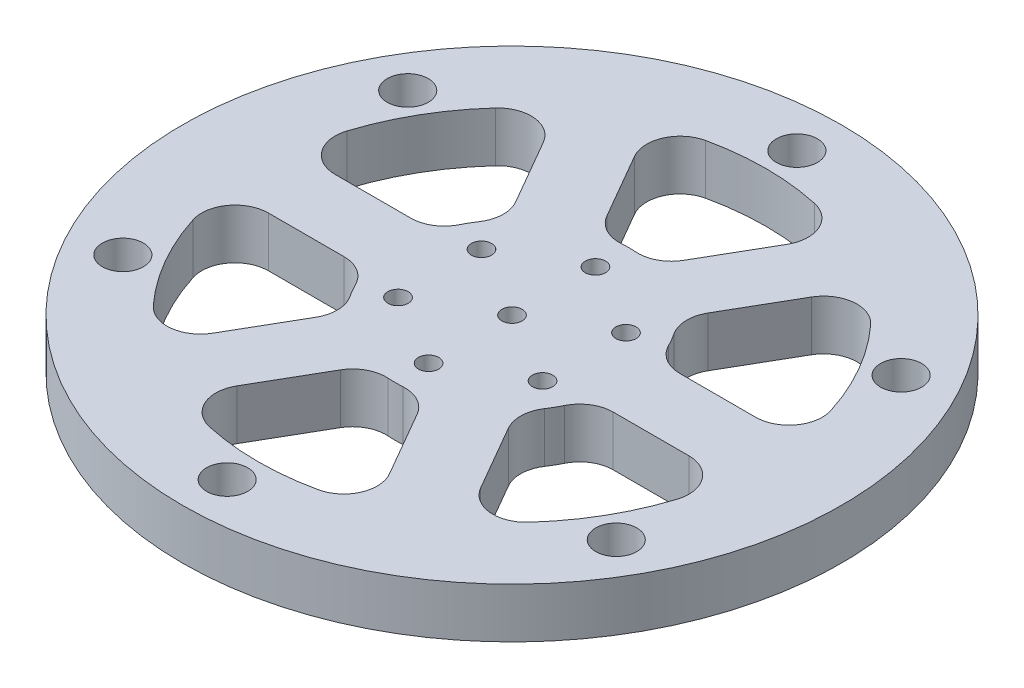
SolidWorks part; units mm, degrees
ref_plane "FRONT" through (0, 0, 0) normal (0, 0, 1) x (1, 0, 0)
ref_plane "TOP" through (0, 0, 0) normal (0, 1, 0) x (1, 0, 0)
ref_plane "RIGHT" through (0, 0, 0) normal (1, 0, 0) x (0, 0, -1)
sketch "Sketch1" plane through (0, 0, 0) normal (0, 1, 0) x (1, 0, 0)
  line L0 (0, 37.0223) -> (0, -37.4376) construction
  line L3 (0, 0) -> (-18.1993, -41.2942) construction
  circle A0 centre (0, 0) radius 31.3531
  circle A1 centre (0, 0) radius 0.9652
  circle A38 centre (0, 0) radius 11.1125 construction
  dimension "D1" = 62.7063
  dimension "D2" = 22.225
  dimension "wireHole" = 1.9304
extrude "Base-Extrude" add sketch "Sketch1" along normal blind 4.7625
sketch "Sketch2" plane through (0, 4.7625, 0) normal (0, 1, 0) x (-1, 0, 0)
  line L0 (0, 0) -> (16.8357, 29.1603) construction
  line L1 (0, -33.3791) -> (0, 35.9142) construction
  line L2 (9.149, 9.4966) -> (12.7498, 15.7332)
  line L3 (12.7988, 3.175) -> (20.0003, 3.175)
  line L4 (0, 0) -> (38.3221, 0) construction
  line L5 (0, 0) -> (38.2595, 22.0891) construction
  arc A0 (9.9546, 4.9389) -> (9.2545, 6.1515) centre (0, 0) ccw
  arc A1 (17.8445, 16.2861) -> (12.7498, 15.7332) centre (15.4994, 14.1457) ccw
  arc A2 (23.0264, 7.3108) -> (17.8445, 16.2861) centre (0, 0) ccw
  arc A3 (9.2545, 6.1515) -> (9.149, 9.4966) centre (11.8987, 7.9091) cw
  arc A4 (9.9546, 4.9389) -> (12.7988, 3.175) centre (12.7988, 6.35) ccw
  arc A5 (23.0264, 7.3108) -> (20.0003, 3.175) centre (20.0003, 6.35) cw
  circle A6 centre (6.8741, 3.9687) radius 0.9652
  circle A7 centre (23.4708, 13.5509) radius 1.9558
  circle A10 centre (23.4708, 13.5509) radius 1.9558 construction
  circle A11 centre (6.8741, 3.9687) radius 0.9652 construction
  dimension "D2" = 22.225
  dimension "D5" = 3.175
  dimension "D1" = 30
  dimension "D3" = 3.175
  dimension "D4" = 3.175
  dimension "D6" = 30
extrude "Cut-Extrude1" cut sketch "Sketch2" against normal through all
pattern_circular "CirPattern1" count 6 every 60 about axis through (0, 0, 0) along (0, 1, 0) of "Cut-Extrude1"
